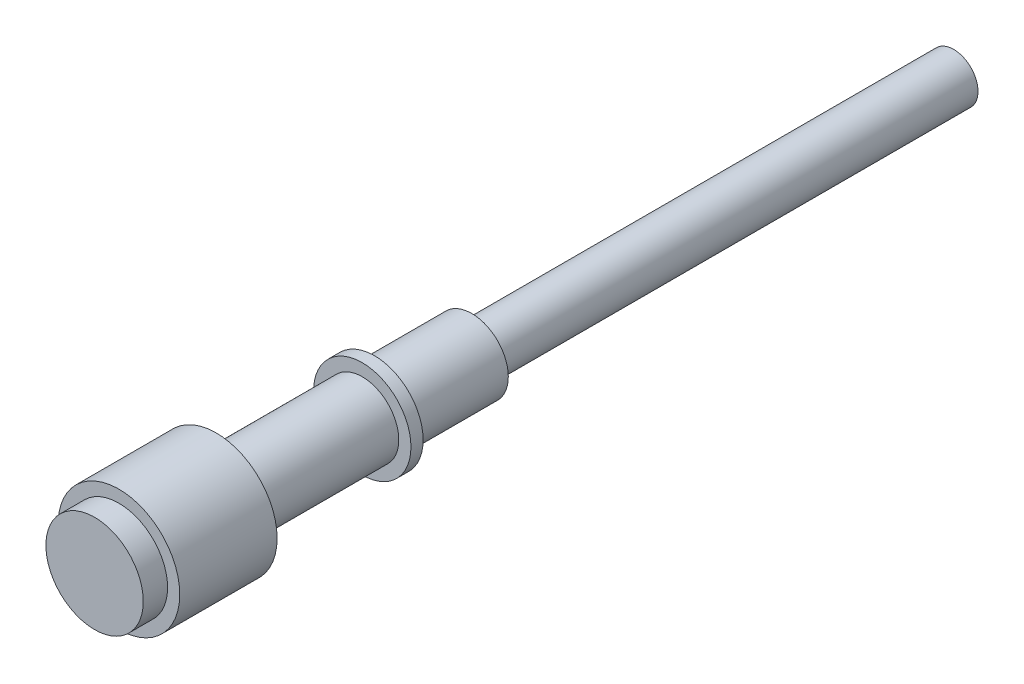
SolidWorks part; units mm, degrees
ref_plane "Front Plane" through (0, 0, 0) normal (0, 0, 1) x (1, 0, 0)
ref_plane "Top Plane" through (0, 0, 0) normal (0, 1, 0) x (1, 0, 0)
ref_plane "Right Plane" through (0, 0, 0) normal (1, 0, 0) x (0, 0, -1)
sketch "Sketch2" plane through (0, 0, 0) normal (0, 0, 1) x (1, 0, 0)
  circle A0 centre (0, 0) radius 6.35
extrude "Boss-Extrude2" add sketch "Sketch2" along normal blind 125.73
sketch "Sketch3" plane through (0, 0, 125.73) normal (0, 0, 1) x (1, 0, 0)
  circle A0 centre (0, 0) radius 9.525
extrude "Boss-Extrude3" add sketch "Sketch3" along normal blind 25.4
sketch "Sketch4" plane through (0, 0, 151.13) normal (0, 0, 1) x (1, 0, 0)
  circle A0 centre (0, 0) radius 12.7
extrude "Boss-Extrude4" add sketch "Sketch4" along normal blind 3.175
sketch "Sketch5" plane through (0, 0, 154.305) normal (0, 0, 1) x (1, 0, 0)
  circle A0 centre (0, 0) radius 9.525
extrude "Boss-Extrude5" add sketch "Sketch5" along normal blind 38.1
sketch "Sketch6" plane through (0, 0, 192.405) normal (0, 0, 1) x (1, 0, 0)
  circle A0 centre (0, 0) radius 15.875
extrude "Boss-Extrude6" add sketch "Sketch6" along normal blind 25.4
sketch "Sketch7" plane through (0, 0, 217.805) normal (0, 0, 1) x (1, 0, 0)
  circle A0 centre (0, 0) radius 12.7
extrude "Boss-Extrude7" add sketch "Sketch7" along normal blind 6.35
